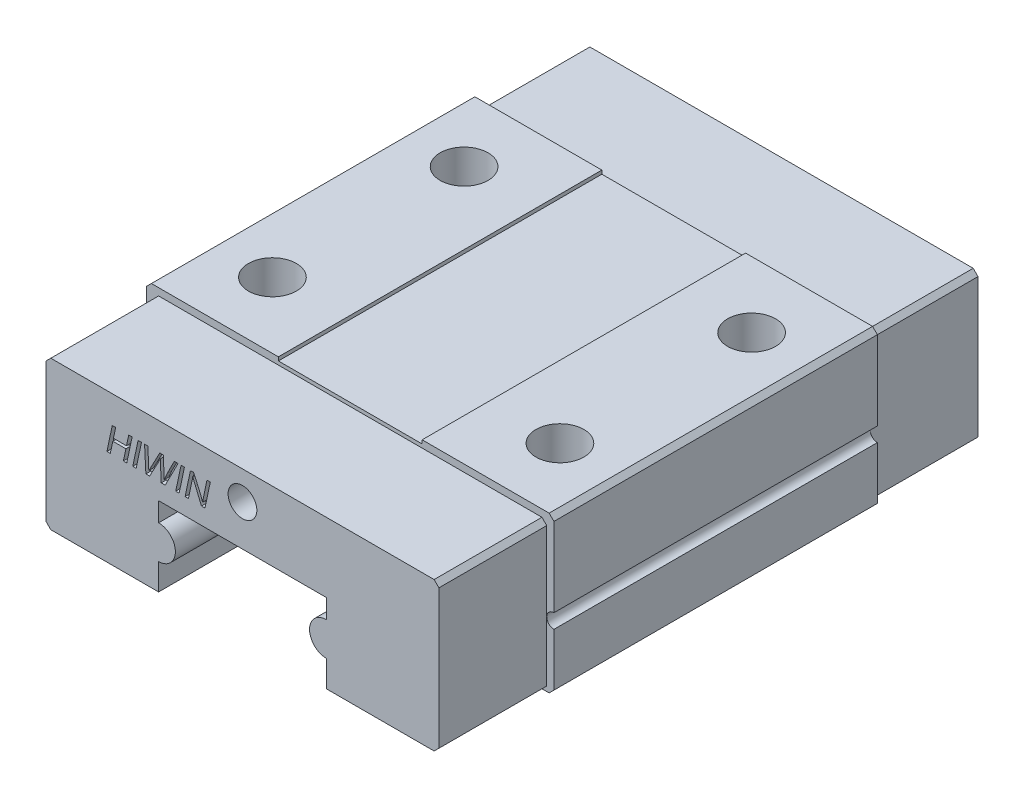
SolidWorks part; units mm, degrees
ref_plane "前视基准面" through (0, 0, 0) normal (0, 0, 1) x (1, 0, 0)
ref_plane "上视基准面" through (0, 0, 0) normal (0, 1, 0) x (1, 0, 0)
ref_plane "右视基准面" through (0, 0, 0) normal (1, 0, 0) x (0, 0, -1)
imported_body "输入1"
hole_wizard "M2 螺纹孔2" positions "草图7" profile "草图6" tap size "M2" standard "ISO"
sketch "草图7" plane through (0, 8, 0) normal (0, 1, 0) x (-1, 0, 0)
  point P1 (6, 4)
  point P4 (-6, 4)
  point P7 (-6, -4)
  point P10 (6, -4)
sketch "草图6" plane through (-6, 8, 4) normal (1, 0, 0) x (0, 0, 1)
  line L0 (0, 0) -> (0, 4.1807)
  line L1 (0, 4.1807) -> (0.8, 3.7)
  line L2 (0.8, 3.7) -> (0.8, 2.5)
  line L3 (0.8, 2.5) -> (1, 2.5)
  line L4 (1, 2.5) -> (1, 0)
  line L5 (1, 0) -> (0, 0)
  line L10 (0, 4.1807) -> (-0.8, 3.7) construction
  line L11 (0, -6.35) -> (0, 107.95) construction
  dimension "螺纹孔钻头直径" = 1.6
  dimension "螺纹孔钻头深度" = 3.7
  dimension "螺纹主直径" = 2
  dimension "螺纹深度" = 2.5
  dimension "导头角度" = 118
